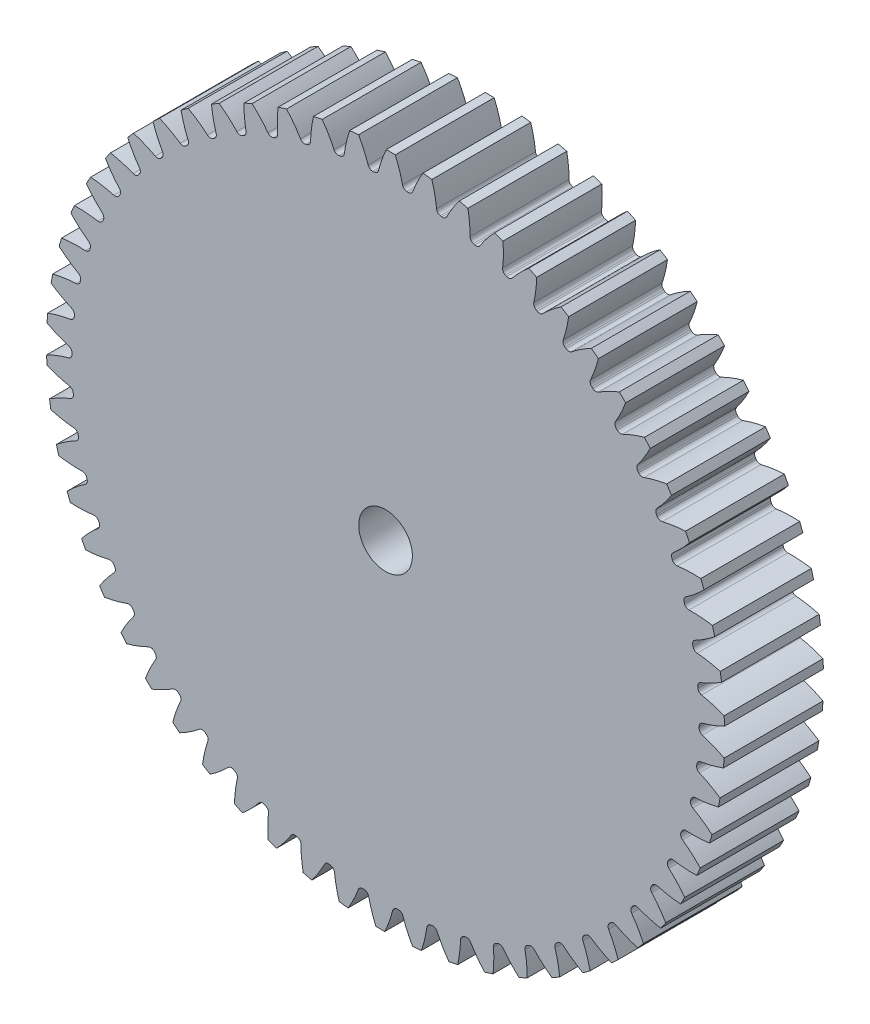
SolidWorks part; units mm, degrees
ref_plane "Front" through (0, 0, 0) normal (0, 0, 1) x (1, 0, 0)
ref_plane "Top" through (0, 0, 0) normal (0, 1, 0) x (1, 0, 0)
ref_plane "Right" through (0, 0, 0) normal (1, 0, 0) x (0, 0, -1)
sketch "Sketch3" plane through (0, 0, 0) normal (0, 0, 1) x (1, 0, 0)
  circle A0 centre (0, 0) radius 304.8
  dimension "od" = 609.6
extrude "gearBody" add sketch "Sketch3" along normal blind 88.9
sketch "Sketch2" plane through (0, 0, 0) normal (0, 0, 1) x (1, 0, 0)
  line L0 (0, 0) -> (255.7955, 105.954) construction
  line L1 (304.4099, -17.289) -> (0, 0) construction
  line L2 (0, 0) -> (36.3143, 0) construction
  line L3 (294.6207, 3.3731) -> (294.3739, -12.5206) construction
  line L5 (294.4973, -4.5737) -> (0, 0) construction
  line L7 (0, 0) -> (276.871, 0) construction
  arc A0 (276.8659, -1.6855) -> (276.7847, -6.913) centre (0, 0) ccw construction
  arc A1 (304.7007, 7.7781) -> (304.3122, -17.2365) centre (0, 0) ccw construction
  arc A2 (294.6207, 3.3731) -> (294.3739, -12.5206) centre (0, 0) ccw construction
  arc A3 (281.8949, -5.0421) -> (281.9155, -3.7142) centre (0, 0) ccw
  arc A4 (304.4099, -17.289) -> (284.8069, -9.0663) centre (252.3818, -113.8463) ccw
  arc A5 (304.4099, -17.289) -> (304.8, 7.8276) centre (0, 0) ccw
  arc A6 (304.8, 7.8276) -> (284.9511, 0.2176) centre (255.7955, 105.954) cw
  arc A7 (281.9155, -3.7142) -> (284.9511, 0.2176) centre (286.0503, -3.7687) cw
  arc A8 (284.8069, -9.0663) -> (281.8949, -5.0421) centre (286.0294, -5.116) cw
  point P6 (304.8, 7.8276)
  point P22 (304.4099, -17.289)
  dimension "baseDia" = 553.7421
  dimension "od" = 609.6
  dimension "pd" = 589.28
  dimension "rd" = 563.88
  dimension "rFillet" = 4.1351
  dimension "pointX" = 304.8
  dimension "pointY" = 7.8276
  dimension "CTT" = 15.8937
  dimension "flankCenterAngle" = 22.5
extrude "toothCut" cut sketch "Sketch2" along normal through all
pattern_circular "CirPattern1" count 58 over 360 about axis through (0, 0, 0) along (0, 0, 1) of "toothCut"
sketch "hub1Dia" plane through (0, 0, 0) normal (0, 0, -1) x (-1, 0, 0)
  circle A0 centre (0, 0) radius 12.7
  dimension "hub1Dia" = 25.4
sketch "hub2Dia" plane through (0, 0, 88.9) normal (0, 0, 1) x (1, 0, 0)
  circle A0 centre (0, 0) radius 12.7
  dimension "hub2dia" = 25.4
sketch "boreDia" plane through (0, 0, 0) normal (0, 0, 1) x (1, 0, 0)
  circle A0 centre (0, 0) radius 24.13
  dimension "boreDia" = 48.26
extrude "bore" cut sketch "boreDia" against normal mid plane 25400
